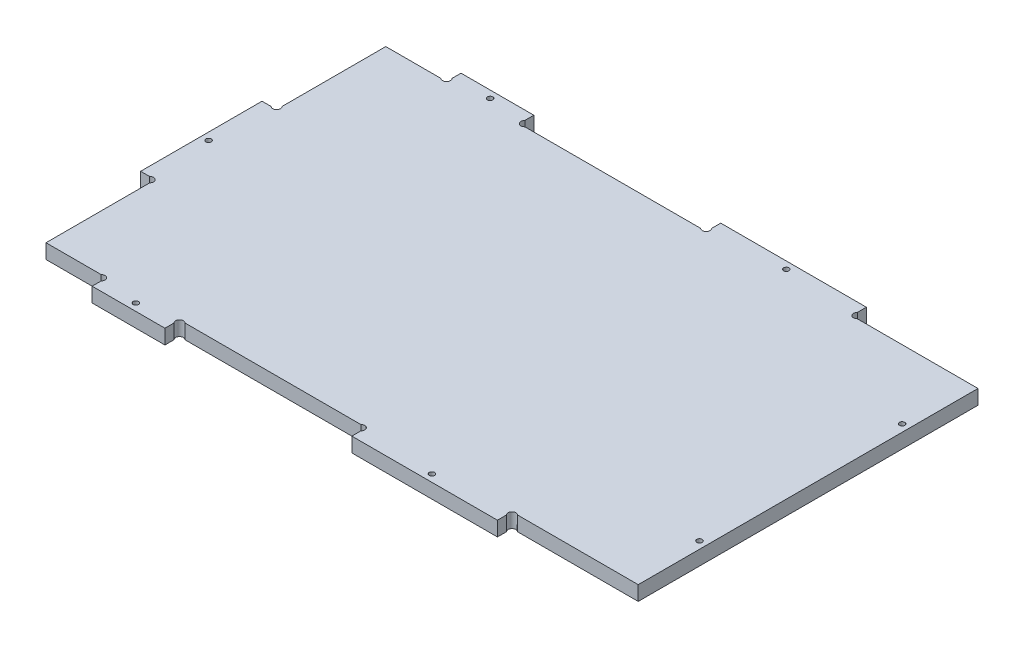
SolidWorks part; units mm, degrees
ref_plane "Plan de face" through (0, 0, 0) normal (0, 0, 1) x (1, 0, 0)
ref_plane "Plan de dessus" through (0, 0, 0) normal (0, 1, 0) x (1, 0, 0)
ref_plane "Plan de droite" through (0, 0, 0) normal (1, 0, 0) x (0, 0, -1)
sketch "Esquisse1" plane through (0, 0, 0) normal (0, 1, 0) x (1, 0, 0)
  line L0 (0, -17.0026) -> (0, 193.7463) construction
  line L1 (-65.4634, 0) -> (262.3041, 0) construction
  line L2 (-65.4634, 152) -> (262.3041, 152) construction
  line L3 (250, 193.7463) -> (250, -17.0026) construction
  line L4 (-45.61, 76) -> (257.252, 76) construction
  line L5 (6, -17.0026) -> (6, 178.5107) construction
  line L6 (125, 131.8413) -> (125, 70.7829) construction
  line L7 (31, 178.5107) -> (31, 142.4654) construction
  line L8 (99.5, 165.8763) -> (99.5, 142.4654) construction
  line L9 (61, 178.5107) -> (61, 142.4654) construction
  line L10 (138, 178.5107) -> (138, 142.4654) construction
  line L11 (198, 178.5107) -> (198, 142.4654) construction
  line L12 (41.3743, 149) -> (176.866, 149) construction
  line L13 (262.3041, 146) -> (-6.1418, 146) construction
  line L14 (46, 165.8763) -> (46, 142.4654) construction
  line L15 (168, 165.8763) -> (168, 142.4654) construction
  line L16 (31, 146) -> (18.5232, 158.4768) construction
  line L17 (-29.5814, 101) -> (10.6276, 101) construction
  line L18 (6, 101) -> (-14.0398, 121.0398) construction
  line L19 (3.7373, 101) -> (0, 101)
  line L20 (3.7373, 51) -> (0, 51)
  line L21 (0, 101) -> (0, 51)
  line L22 (6, 103.2627) -> (6, 146)
  line L23 (6, 146) -> (28.7373, 146)
  line L24 (31, 148.2627) -> (31, 152)
  line L25 (31, 152) -> (61, 152)
  line L26 (61, 152) -> (61, 148.2627)
  line L27 (63.2627, 146) -> (135.7373, 146)
  line L28 (138, 148.2627) -> (138, 152)
  line L29 (138, 152) -> (198, 152)
  line L30 (198, 152) -> (198, 148.2627)
  line L31 (200.2627, 146) -> (250, 146)
  line L32 (200.2627, 6) -> (250, 6)
  line L33 (198, 0) -> (198, 3.7373)
  line L34 (138, 0) -> (198, 0)
  line L35 (138, 3.7373) -> (138, 0)
  line L36 (63.2627, 6) -> (135.7373, 6)
  line L37 (61, 0) -> (61, 3.7373)
  line L38 (31, 0) -> (61, 0)
  line L39 (31, 3.7373) -> (31, 0)
  line L40 (6, 6) -> (28.7373, 6)
  line L41 (6, 48.7373) -> (6, 6)
  line L42 (250, 146) -> (250, 6)
  line L43 (233.5765, 62.5) -> (257.252, 62.5) construction
  line L44 (262.3041, 34.25) -> (239.2135, 34.25) construction
  line L45 (247, 25.2954) -> (247, 40.8536) construction
  line L47 (3, 83.5846) -> (3, 61.1353) construction
  arc A0 (28.7373, 146) -> (31, 148.2627) centre (29.8686, 147.1314) ccw
  arc A1 (63.2627, 146) -> (61, 148.2627) centre (62.1314, 147.1314) cw
  arc A2 (135.7373, 146) -> (138, 148.2627) centre (136.8686, 147.1314) ccw
  arc A3 (200.2627, 146) -> (198, 148.2627) centre (199.1314, 147.1314) cw
  arc A4 (3.7373, 101) -> (6, 103.2627) centre (4.8686, 102.1314) ccw
  arc A5 (3.7373, 51) -> (6, 48.7373) centre (4.8686, 49.8686) cw
  arc A6 (200.2627, 6) -> (198, 3.7373) centre (199.1314, 4.8686) ccw
  arc A7 (135.7373, 6) -> (138, 3.7373) centre (136.8686, 4.8686) cw
  arc A8 (63.2627, 6) -> (61, 3.7373) centre (62.1314, 4.8686) ccw
  arc A9 (28.7373, 6) -> (31, 3.7373) centre (29.8686, 4.8686) cw
  circle A10 centre (247, 34.25) radius 1.1
  circle A11 centre (247, 117.75) radius 1.1
  circle A12 centre (46, 149) radius 1.1
  circle A13 centre (3, 76) radius 1.1
  circle A14 centre (168, 149) radius 1.1
  circle A15 centre (168, 3) radius 1.1
  circle A16 centre (46, 3) radius 1.1
  dimension "D16" = 25
  dimension "D18" = 3
  dimension "D19" = 13.5
  dimension "D1" = 152
  dimension "D2" = 76
  dimension "D3" = 250
  dimension "D4" = 125
  dimension "D5" = 6
  dimension "D6" = 30
  dimension "D7" = 3
  dimension "D8" = 60
  dimension "D9" = 77
  dimension "D10" = 25
  dimension "D11" = 6
  dimension "D12" = 15
  dimension "D13" = 38.5
  dimension "D14" = 30
  dimension "D15" = 45
  dimension "D17" = 45
  dimension "D20" = 28.25
  dimension "D21" = 3
extrude "Boss.-Extru.1" add sketch "Esquisse1" along normal blind 6
